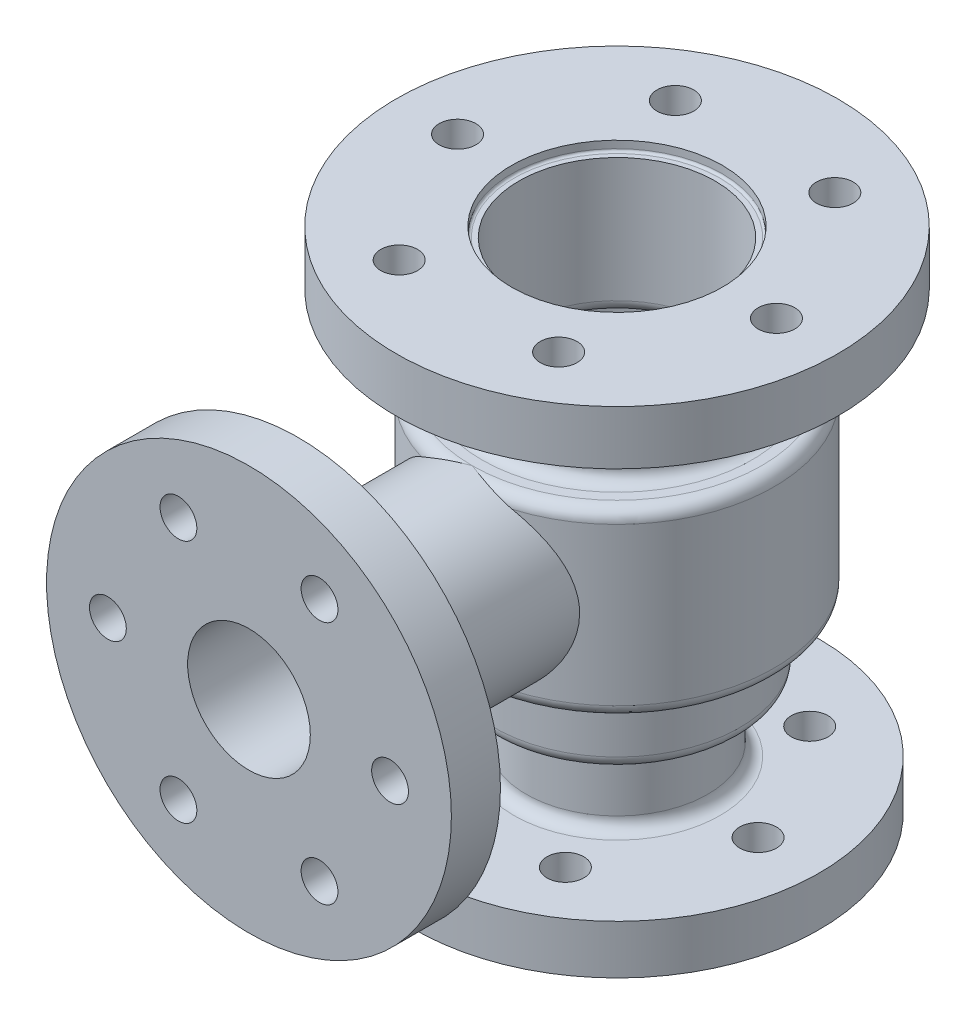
SolidWorks part; units mm, degrees
ref_plane "Plane1" through (0, 0, 0) normal (0, 0, 1) x (1, 0, 0)
ref_plane "Plane2" through (0, 0, 0) normal (0, 1, 0) x (1, 0, 0)
ref_plane "Plane3" through (0, 0, 0) normal (1, 0, 0) x (0, 0, -1)
sketch "Sketch1" plane through (0, 0, 0) normal (0, 0, 1) x (1, 0, 0)
  line L0 (25, 0) -> (82.5, 0)
  line L1 (82.5, 0) -> (82.5, 20)
  line L2 (82.5, 20) -> (42, 20)
  line L3 (37, 25) -> (37, 45)
  line L4 (42, 50) -> (45, 50)
  line L5 (50, 55) -> (50, 73)
  line L7 (59, 78) -> (55, 78)
  line L8 (64, 83) -> (64, 147)
  line L9 (59, 152) -> (55, 152)
  line L10 (50, 157) -> (50, 180)
  line L11 (55, 185) -> (90, 185)
  line L12 (90, 185) -> (90, 207)
  line L13 (90, 207) -> (69.4445, 207)
  line L14 (0, -30.7407) -> (0, 105.0904) construction
  line L15 (69.4445, 207) -> (43, 207)
  line L16 (43, 207) -> (43, 203)
  line L17 (43, 203) -> (40, 203)
  line L18 (40, 203) -> (40, 152.4665)
  line L19 (45, 147.4665) -> (46, 147.4665)
  line L20 (46, 147.4665) -> (46, 89.9192)
  line L21 (46, 89.9192) -> (40, 89.9192)
  line L22 (40, 89.9192) -> (40, 87.9192)
  line L23 (40, 87.9192) -> (35, 87.9192)
  line L24 (35, 87.9192) -> (35, 72.9192)
  line L25 (35, 72.9192) -> (25, 72.9192)
  line L26 (25, 72.9192) -> (25, 0)
  arc A0 (55, 152) -> (50, 157) centre (55, 157) cw
  arc A1 (45, 147.4665) -> (40, 152.4665) centre (45, 152.4665) cw
  arc A2 (42, 20) -> (37, 25) centre (42, 25) cw
  arc A3 (42, 50) -> (37, 45) centre (42, 45) ccw
  arc A4 (50, 55) -> (45, 50) centre (45, 55) cw
  arc A5 (55, 78) -> (50, 73) centre (55, 73) ccw
  arc A6 (59, 152) -> (64, 147) centre (59, 147) cw
  arc A7 (55, 185) -> (50, 180) centre (55, 180) ccw
  arc A8 (64, 83) -> (59, 78) centre (59, 83) cw
  point P42 (64, 152)
  point P46 (64, 78)
  dimension "D16" = 5
  dimension "D23" = 5
  dimension "D24" = 5
  dimension "D12" = 5
  dimension "D1" = 82.5
  dimension "D2" = 37
  dimension "D3" = 50
  dimension "D4" = 64
  dimension "D5" = 50
  dimension "D6" = 90
  dimension "D7" = 20
  dimension "D8" = 50
  dimension "D9" = 22
  dimension "D10" = 207
  dimension "D11" = 74
  dimension "D13" = 43
  dimension "D14" = 4
  dimension "D15" = 46
  dimension "D17" = 10
  dimension "D18" = 40
  dimension "D19" = 2
  dimension "D20" = 70
  dimension "D21" = 15
  dimension "D22" = 50
revolve "Base-Revolve" add sketch "Sketch1" angle 360 about L14
sketch "Sketch2" plane through (0, 0, 0) normal (1, 0, 0) x (0, 0, -1)
  line L0 (-226.0358, 115) -> (254.7722, 115) construction
  line L1 (-82.5, 0) -> (82.5, 0) construction
  line L2 (-57.0738, 152) -> (-130, 152)
  line L3 (59, 152) -> (-59, 152) construction
  line L4 (-130, 152) -> (-130, 197.5)
  line L5 (-130, 197.5) -> (-150, 197.5)
  line L6 (-150, 197.5) -> (-150, 140)
  line L8 (-46, 147.4665) -> (-46, 89.9192) construction
  line L9 (-57.0738, 152) -> (-46, 152)
  line L10 (55, 152) -> (-55, 152) construction
  line L11 (-46, 152) -> (-46, 140)
  line L12 (-150, 140) -> (-150, 115)
  line L13 (-150, 115) -> (-46, 115)
  line L14 (-46, 115) -> (-46, 140)
  dimension "D1" = 115
  dimension "D2" = 165
  dimension "D4" = 20
  dimension "D5" = 150
revolve "Boss-Revolve1" add sketch "Sketch2" angle 360 about L0
sketch "Sketch3" plane through (0, 0, 0) normal (1, 0, 0) x (0, 0, -1)
  line L0 (-174.5116, 115) -> (92.0447, 115) construction
  line L1 (-150, 197.5) -> (-150, 32.5) construction
  line L2 (-150, 140) -> (-150, 115)
  line L3 (-150, 140) -> (-32.4752, 140)
  line L4 (-32.4752, 140) -> (-32.4752, 115)
  line L5 (-150, 115) -> (-32.4752, 115)
  dimension "D1" = 115
  dimension "D2" = 50
revolve "Cut-Revolve1" cut sketch "Sketch3" angle 360 about L0
sketch "Sketch4" plane through (0, 207, 0) normal (0, 1, 0) x (-1, 0, 0)
  line L0 (0, 0) -> (0, 110.3532) construction
  line L1 (0, 226.0358) -> (0, -254.7722) construction
  circle A0 centre (65, 0) radius 7.5
  dimension "D2" = 15
  dimension "D1" = 130
extrude "Cut-Extrude1" cut sketch "Sketch4" against normal blind 22
sketch "Sketch5" plane through (93.9226, 20, -43.9586) normal (0, 1, 0) x (-1, 0, 0)
  line L0 (93.9226, 0) -> (93.9226, 87.9171) construction
  circle A0 centre (151.4226, 43.9586) radius 7.5
  dimension "D2" = 15
  dimension "D1" = 115
extrude "Cut-Extrude2" cut sketch "Sketch5" against normal blind 22
pattern_circular "CirPattern1" count 6 over 360 about axis through (0, 0, 0) along (0, 1, 0) of "Cut-Extrude2", "Cut-Extrude1"
sketch "Sketch6" plane through (-95.6155, 103.863, 150) normal (0, 0, 1) x (1, 0, 0)
  line L2 (95.6155, 91.1226) -> (95.6155, -68.8486) construction
  line L3 (95.6155, -134.6037) -> (95.6155, 1.2274) construction
  circle A0 centre (38.1155, 11.137) radius 7.5
  dimension "D2" = 15
  dimension "D1" = 115
extrude "Cut-Extrude3" cut sketch "Sketch6" against normal blind 22
pattern_circular "CirPattern2" count 6 over 360 about axis through (0, 115, 0) along (0, 0, 1) of "Cut-Extrude3"
fillet "Fillet2" radius 1 1 edges at (0, 203, -43)
